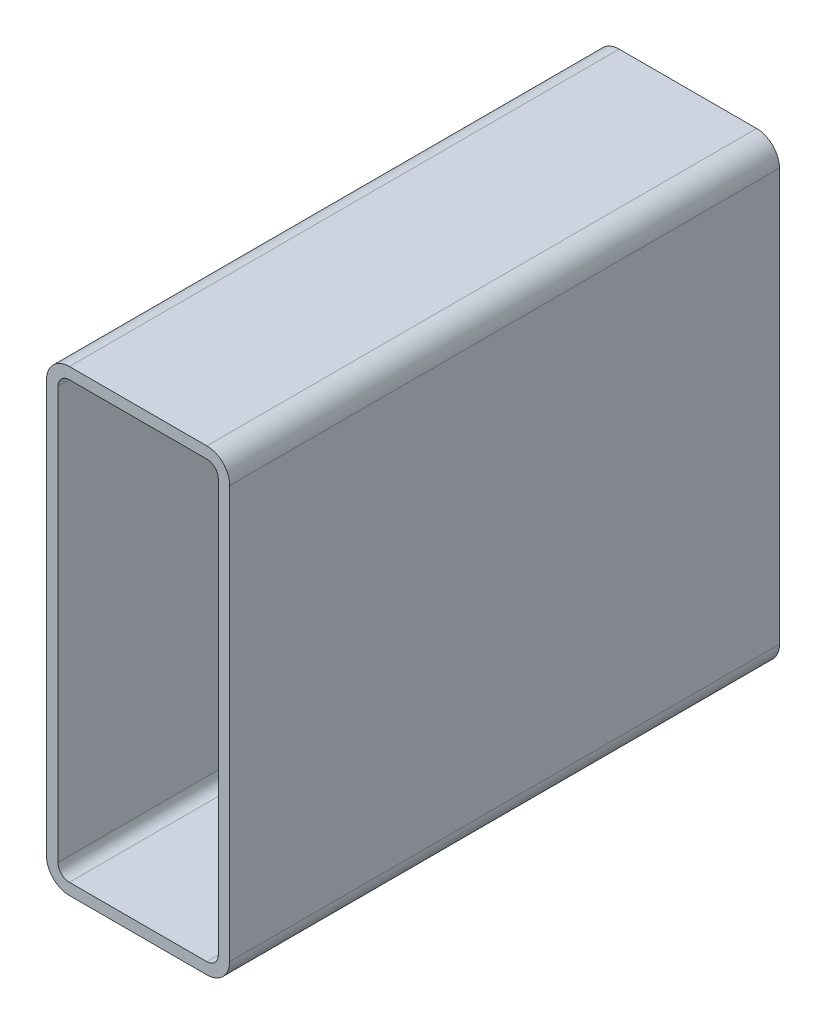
SolidWorks part; units mm, degrees
ref_plane "Front Plane" through (0, 0, 0) normal (0, 0, 1) x (1, 0, 0)
ref_plane "Top Plane" through (0, 0, 0) normal (0, 1, 0) x (1, 0, 0)
ref_plane "Right Plane" through (0, 0, 0) normal (1, 0, 0) x (0, 0, -1)
sketch "Sketch1" plane through (0, 0, 0) normal (0, 0, 1) x (1, 0, 0)
sketch_block_instance "HSS10x4x0.250-1"
sketch_block "HSS10x4x0.250"
extrude "Boss-Extrude1" add sketch "Sketch1" along normal blind 304.8
